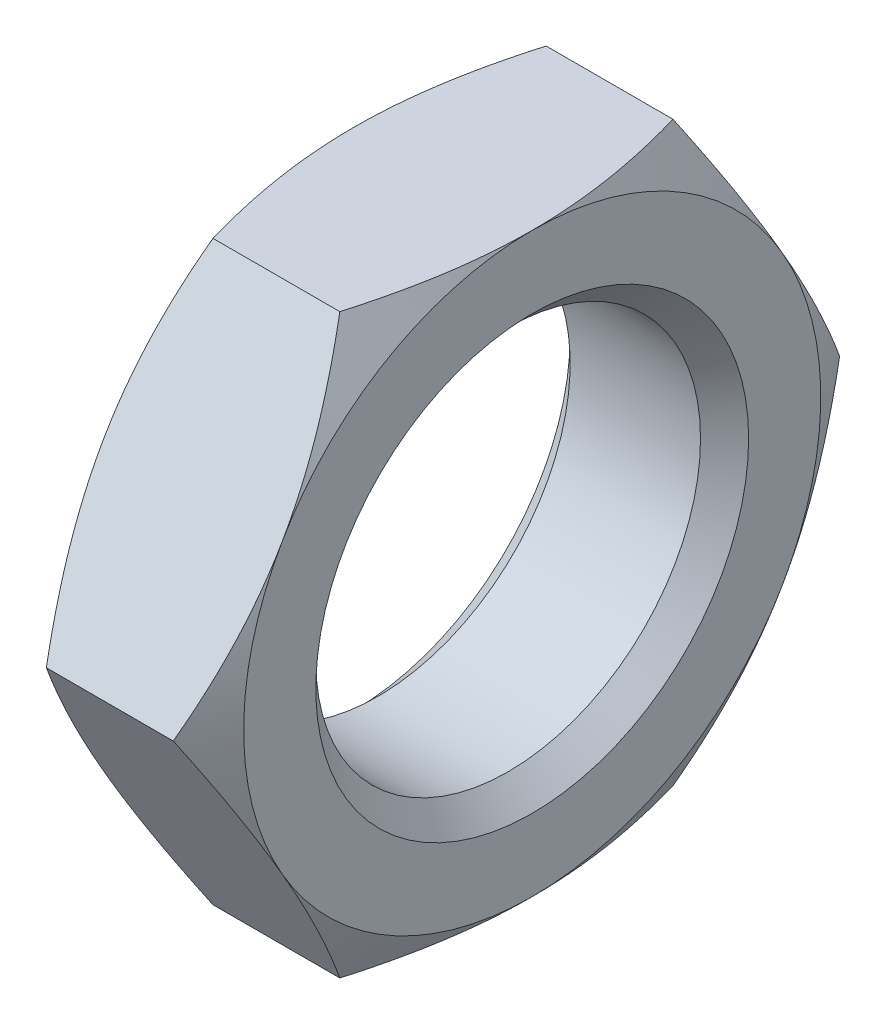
SolidWorks part; units mm, degrees
ref_plane "Front Plane" through (0, 0, 0) normal (0, 0, 1) x (1, 0, 0)
ref_plane "Top Plane" through (0, 0, 0) normal (0, 1, 0) x (1, 0, 0)
ref_plane "Right Plane" through (0, 0, 0) normal (1, 0, 0) x (0, 0, -1)
sketch "Sketch1" plane through (0, 0, 0) normal (1, 0, 0) x (0, 0, -1)
  line L1 (6.9282, 12) -> (-6.9282, 12)
  line L2 (-6.9282, 12) -> (-13.8564, 0)
  line L3 (-13.8564, 0) -> (-6.9282, -12)
  line L4 (-6.9282, -12) -> (6.9282, -12)
  line L5 (6.9282, -12) -> (13.8564, 0)
  line L6 (13.8564, 0) -> (6.9282, 12)
  circle A0 centre (0, 0) radius 12 construction
  circle A1 centre (0, 0) radius 8
extrude "Extrude1" add sketch "Sketch1" along normal blind 7.42
sketch "Sketch2" plane through (0, 0, 0) normal (0, 0, 1) x (1, 0, 0)
  line L0 (7.42, 12) -> (7.42, 48)
  line L1 (7.42, 48) -> (0, 48)
  line L2 (0, 48) -> (0, 12)
  line L3 (0, 12) -> (3.71, 18.4259)
  line L4 (3.71, 18.4259) -> (7.42, 12)
revolve "Cut-Revolve1" cut sketch "Sketch2" angle 360 about axis through (7.42, 0, 0) along (-1, 0, 0)
chamfer "Chamfer1" distance 1 angle 45 2 edges at (0, 0, -8) (7.42, 0, -8)
equation "\"D2@Sketch2\"=\"D1@Sketch1\"*2"
